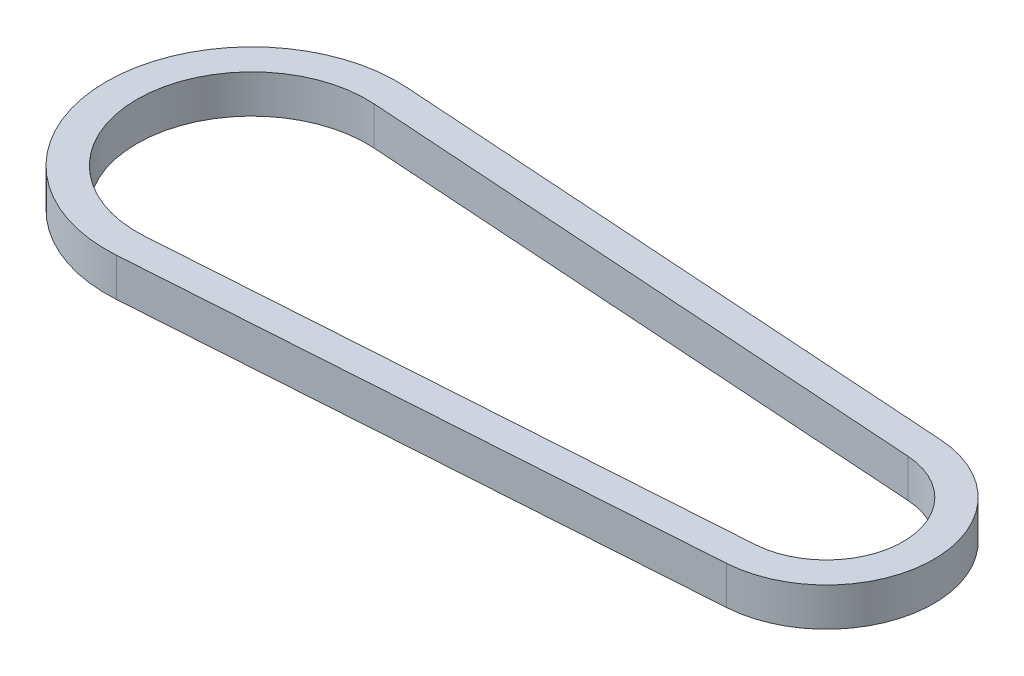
SolidWorks part; units mm, degrees
ref_plane "Front Plane" through (0, 0, 0) normal (0, 0, 1) x (1, 0, 0)
ref_plane "Top Plane" through (0, 0, 0) normal (0, 1, 0) x (1, 0, 0)
ref_plane "Right Plane" through (0, 0, 0) normal (1, 0, 0) x (0, 0, -1)
sketch "Sketch1" plane through (0, 0, 0) normal (0, 1, 0) x (1, 0, 0)
  line L0 (0, 0) -> (150, 0) construction
  line L1 (2, 29.9333) -> (151.3333, 19.9555)
  line L2 (2.5333, 37.9155) -> (151.8667, 27.9377)
  line L3 (2, -29.9333) -> (151.3333, -19.9555)
  line L4 (2.5333, -37.9155) -> (151.8667, -27.9377)
  arc A0 (2, 29.9333) -> (2, -29.9333) centre (0, 0) ccw
  arc A1 (151.3333, -19.9555) -> (151.3333, 19.9555) centre (150, 0) ccw
  arc A2 (151.8667, -27.9377) -> (151.8667, 27.9377) centre (150, 0) ccw
  arc A3 (2.5333, 37.9155) -> (2.5333, -37.9155) centre (0, 0) ccw
  dimension "D1" = 40
  dimension "D2" = 60
  dimension "D3" = 150
  dimension "D4" = 8
extrude "Boss-Extrude1" add sketch "Sketch1" along normal blind 10
